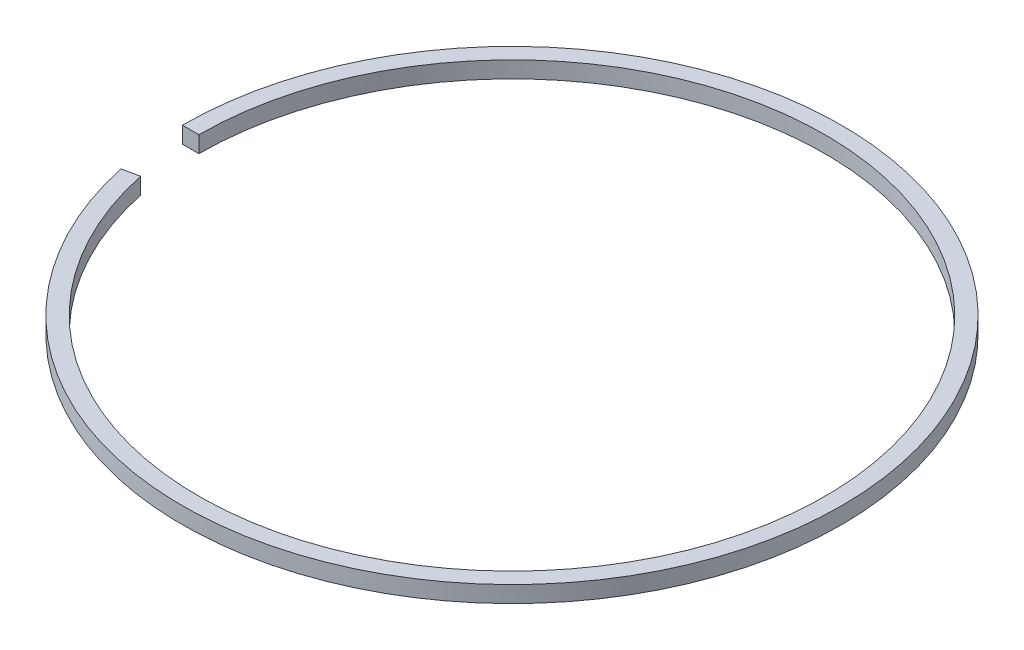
SolidWorks part; units mm, degrees
ref_plane "Front Plane" through (0, 0, 0) normal (0, 0, 1) x (1, 0, 0)
ref_plane "Top Plane" through (0, 0, 0) normal (0, 1, 0) x (1, 0, 0)
ref_plane "Right Plane" through (0, 0, 0) normal (1, 0, 0) x (0, 0, -1)
sketch "Sketch1" plane through (0, 0, 0) normal (0, 0, 1) x (1, 0, 0)
  line L0 (0, 25.5311) -> (0, -16.5204) construction
  line L1 (-63.5, 3.175) -> (-60.325, 3.175)
  line L2 (-63.5, 3.175) -> (-63.5, 0)
  line L3 (-63.5, 0) -> (-60.325, 0)
  line L4 (-60.325, 3.175) -> (-60.325, 0)
  line L5 (-63.5, 3.175) -> (-60.325, 0) construction
  line L6 (-63.5, 0) -> (-60.325, 3.175) construction
  point P0 (-61.9125, 1.5875)
  dimension "D1" = 3.175
  dimension "D2" = 0
  dimension "D3" = 60.325
revolve "Revolve1" add sketch "Sketch1" angle 348 about L0
